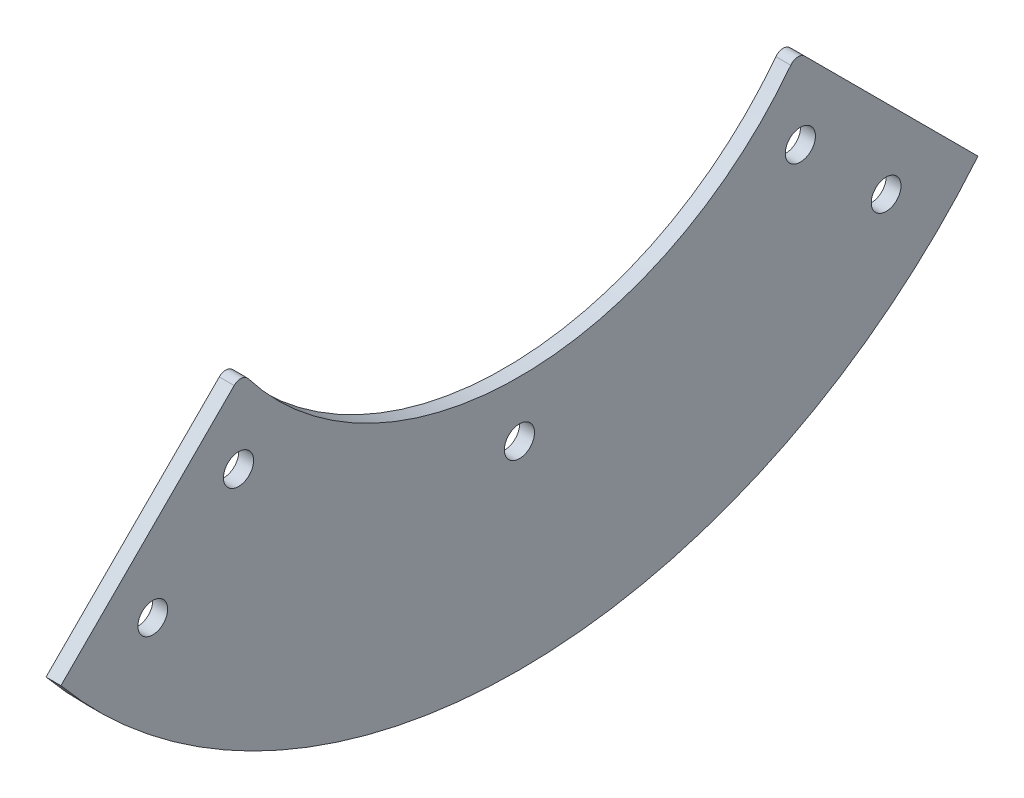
SolidWorks part; units mm, degrees
ref_plane "Piano frontale" through (0, 0, 0) normal (0, 0, 1) x (1, 0, 0)
ref_plane "Piano superiore" through (0, 0, 0) normal (0, 1, 0) x (1, 0, 0)
ref_plane "Piano destro" through (0, 0, 0) normal (1, 0, 0) x (0, 0, -1)
sketch "Schizzo1" plane through (0, 0, 0) normal (1, 0, 0) x (0, 0, -1)
  line L0 (-86.1029, -64.8897) -> (-76.6755, -55.4623)
  line L1 (86.1029, -64.8897) -> (76.6755, -55.4623)
  line L2 (-86.1029, -64.8897) -> (-123.2454, -102.0322)
  line L3 (86.1029, -64.8897) -> (123.2454, -102.0322)
  arc A0 (-72.9211, -55.7123) -> (72.9211, -55.7123) centre (0, 0) ccw
  arc A1 (-72.9211, -55.7123) -> (-76.6755, -55.4623) centre (-74.9077, -57.23) ccw
  arc A2 (76.6755, -55.4623) -> (72.9211, -55.7123) centre (74.9077, -57.23) ccw
  circle A3 centre (75.4963, -75.4963) radius 4.05
  circle A4 centre (-75.4963, -75.4963) radius 4.05
  circle A5 centre (-98.5517, -98.5517) radius 4
  circle A6 centre (98.5517, -98.5517) radius 4
  circle A7 centre (0, -106.7679) radius 4.05
  arc A9 (-123.2454, -102.0322) -> (123.2454, -102.0322) centre (0, 0) ccw
  dimension "D1" = 8
  dimension "D2" = 8.1
  dimension "D3" = 91.7679
  dimension "D4" = 2.5
  dimension "D5" = 160
  dimension "D6" = 72.9211
  dimension "D7" = 75.4963
  dimension "D8" = 86.1029
  dimension "D9" = 98.5517
  dimension "D10" = 75.4963
  dimension "D11" = 98.5517
  dimension "D12" = 75.4963
  dimension "D13" = 98.5517
  dimension "D14" = 106.7679
extrude "Estrusione-Estrusione2" add sketch "Schizzo1" along normal blind 4 contours L2 A9 L3 L1 A2 A0 A1 L0 A3 A4 A5 A6 A7
